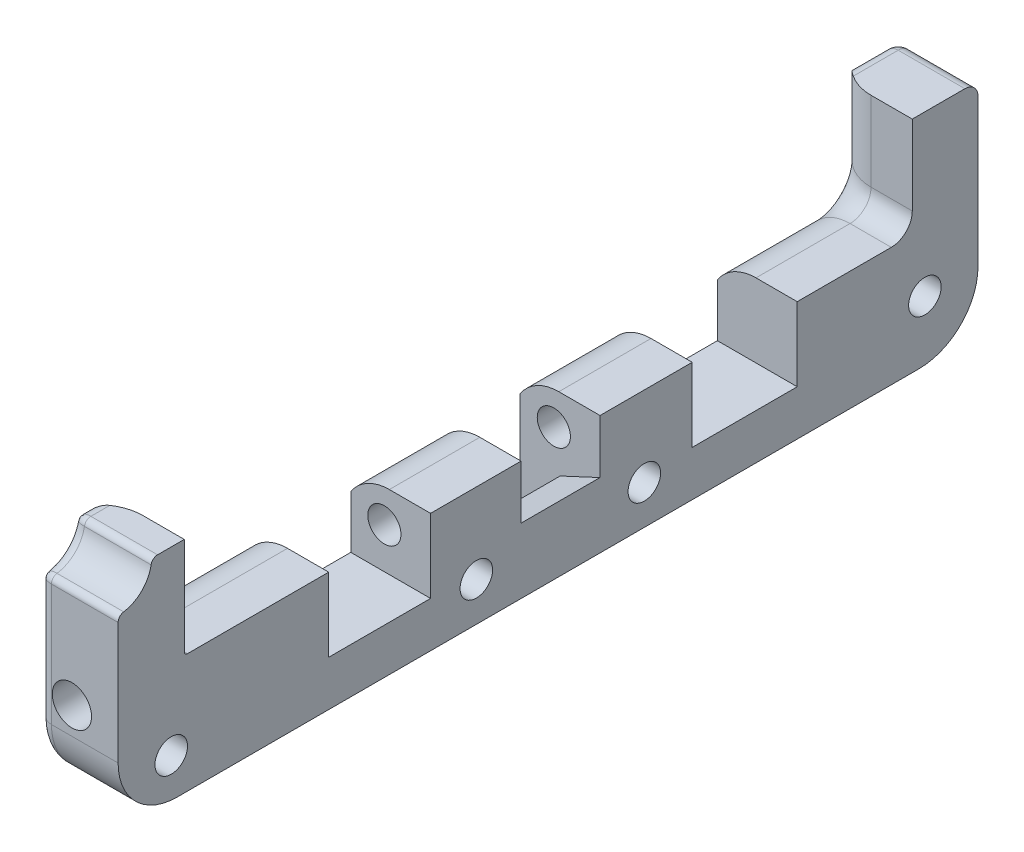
SolidWorks part; units mm, degrees
ref_plane "Спереди" through (0, 0, 0) normal (0, 0, 1) x (1, 0, 0)
ref_plane "Сверху" through (0, 0, 0) normal (0, 1, 0) x (1, 0, 0)
ref_plane "Справа" through (0, 0, 0) normal (1, 0, 0) x (0, 0, -1)
sketch "Эскиз1" plane through (0, 0, 0) normal (1, 0, 0) x (0, 0, -1)
  line L0 (-1.6541, 21.844) -> (1.5748, 21.844)
  line L1 (1.5748, 21.844) -> (1.5748, 10.0743)
  line L2 (1.9717, 9.6774) -> (19.05, 9.6774)
  line L3 (19.05, 9.6774) -> (19.05, 0.762)
  line L4 (19.05, 0.762) -> (31.369, 0.762)
  line L5 (31.369, 0.762) -> (31.369, 9.6774)
  line L6 (31.369, 9.6774) -> (42.3164, 9.6774)
  line L7 (42.3164, 9.6774) -> (42.3164, 3.175)
  line L8 (42.3164, 3.175) -> (51.8668, 3.175)
  line L9 (51.8668, 3.175) -> (51.8668, 9.6774)
  line L10 (51.8668, 9.6774) -> (63.0174, 9.6774)
  line L11 (63.0174, 9.6774) -> (63.0174, 0.762)
  line L12 (63.0174, 0.762) -> (75.7174, 0.762)
  line L13 (75.7174, 0.762) -> (75.7174, 9.6774)
  line L14 (75.7174, 9.6774) -> (87.0966, 9.6774)
  line L15 (89.6366, 12.2174) -> (89.6366, 21.844)
  line L16 (89.6366, 21.844) -> (95.9993, 21.844)
  line L17 (97.5868, 20.2565) -> (97.5868, 2.4194)
  line L18 (90.443, -4.7244) -> (0.7176, -4.7244)
  line L19 (-6.4262, 2.4194) -> (-6.4262, 17.1359)
  circle A0 centre (0, 0) radius 1.9685
  circle A1 centre (36.9062, 0) radius 1.9685
  circle A2 centre (57.2262, 0) radius 1.9685
  circle A3 centre (91.1606, 2.54) radius 1.9685
  arc A4 (-5.752, 17.9206) -> (-2.4368, 21.1825) centre (-6.35, 21.844) ccw
  arc A5 (-5.752, 17.9206) -> (-6.4262, 17.1359) centre (-5.6324, 17.1359) ccw
  arc A6 (-2.4368, 21.1825) -> (-1.6541, 21.844) centre (-1.6541, 21.0503) cw
  arc A7 (97.5868, 2.4194) -> (90.443, -4.7244) centre (90.443, 2.4194) cw
  arc A8 (0.7176, -4.7244) -> (-6.4262, 2.4194) centre (0.7175, 2.4194) cw
  arc A9 (95.9993, 21.844) -> (97.5868, 20.2565) centre (95.9993, 20.2565) cw
  arc A10 (87.0966, 9.6774) -> (89.6366, 12.2174) centre (87.0966, 12.2174) ccw
  arc A11 (1.5748, 10.0743) -> (1.9717, 9.6774) centre (1.9717, 10.0743) ccw
  point P35 (-2.3813, 21.844)
  dimension "D1" = 3.937
  dimension "D22" = 3.9688
  dimension "D23" = 0.7937
  dimension "D24" = 0.7937
  dimension "D25" = 7.1437
  dimension "D26" = 1.5875
  dimension "D27" = 2.54
  dimension "D28" = 0.3969
  dimension "D2" = 36.9062
  dimension "D3" = 57.2262
  dimension "D4" = 91.1606
  dimension "D5" = 2.54
  dimension "D6" = 9.6774
  dimension "D7" = 26.5684
  dimension "D8" = 19.05
  dimension "D9" = 5.4864
  dimension "D10" = 3.175
  dimension "D11" = 1.5748
  dimension "D12" = 104.013
  dimension "D13" = 6.4262
  dimension "D14" = 2.3813
  dimension "D15" = 9.5504
  dimension "D16" = 31.369
  dimension "D17" = 42.3164
  dimension "D18" = 63.0174
  dimension "D19" = 75.7174
  dimension "D20" = 89.6366
  dimension "D21" = 4.7244
extrude "Бобышка-Вытянуть1" add sketch "Эскиз1" along normal blind 9.652
sketch "Эскиз2" plane through (0, 0, 6.4262) normal (0, 0, 1) x (1, 0, 0)
  line L0 (9.652, 17.1359) -> (9.652, 2.4194) construction
  circle A0 centre (4.064, 5.6769) radius 2.3749
  dimension "D1" = 4.7498
  dimension "D2" = 5.6769
  dimension "D3" = 5.588
extrude "Вырез-Вытянуть1" cut sketch "Эскиз2" against normal up to surface (25.4762 mm away)
sketch "Эскиз3" plane through (0, 0, -31.369) normal (0, 0, 1) x (1, 0, 0)
  circle A0 centre (4.064, 5.6769) radius 2.0066
  circle A1 centre (4.064, 5.6769) radius 2.3749 construction
  dimension "D1" = 4.0132
extrude "Вырез-Вытянуть2" cut sketch "Эскиз3" against normal up to surface (31.6484 mm away)
sketch "Эскиз4" plane through (0, 0, -51.8668) normal (0, 0, 1) x (1, 0, 0)
  line L0 (9.652, 3.175) -> (4.826, 0.9246)
  line L1 (9.652, 9.6774) -> (9.652, 3.175) construction
  line L2 (9.652, 3.175) -> (0, 3.175) construction
  line L3 (4.826, 0.9246) -> (4.826, -4.7244)
  line L4 (4.826, -4.7244) -> (0, -4.7244)
  line L5 (0, -4.7244) -> (0, 3.175)
  line L6 (0, 3.175) -> (9.652, 3.175)
  line L7 (0, 9.6774) -> (0, 3.175) construction
  line L8 (9.652, -4.7244) -> (0, -4.7244) construction
  dimension "D1" = 25
  dimension "D2" = 4.826
extrude "Вырез-Вытянуть3" cut sketch "Эскиз4" along normal up to surface (9.5504 mm away)
chamfer "Фаска1" distance 1.5748 angle 30 4 edges at (0, 0, -1.9685) (0, 0, -38.8747) (0, 0, -59.1947) (0, 2.54, -93.1291)
fillet "Скругление1" radius 1.5875 12 edges at (0, 21.379, -97.1218) (0, 21.844, -92.8179) (0, 11.3379, -97.5868) (0, -2.632, -95.4944) (0, 21.6565, 2.1665) (0, 17.6531, 6.2345) (0, -4.7244, -21.517) (0, -2.632, 4.3338) (0, 21.844, 0.0397) (0, 19.015, 3.5665) (0, -4.7244, -71.1549) (0, 9.7776, 6.4262)
sketch "Эскиз5" plane through (0, 0, 0) normal (-1, 0, 0) x (0, 0, 1)
  line L0 (-1.5748, 21.844) -> (-1.5748, 10.0743)
  line L1 (-1.5748, 10.0743) -> (-1.5748, 20.2565) construction
  line L2 (-95.9993, 21.844) -> (-89.6366, 21.844) construction
  line L3 (-19.05, 9.6774) -> (-1.9717, 9.6774) construction
  line L4 (-1.9717, 9.6774) -> (-87.0966, 9.6774)
  line L5 (-87.0966, 9.6774) -> (-75.7174, 9.6774) construction
  line L6 (-1.5748, 21.844) -> (1.6541, 21.844) construction
  line L7 (-89.6366, 20.2565) -> (-89.6366, 12.2174) construction
  line L8 (-89.6366, 12.2174) -> (-89.6366, 21.844)
  arc A0 (-87.0966, 9.6774) -> (-89.6366, 12.2174) centre (-87.0966, 12.2174) cw
  arc A1 (-1.5748, 10.0743) -> (-1.9717, 9.6774) centre (-1.9717, 10.0743) cw
  arc A2 (-1.9717, 9.6774) -> (-1.5748, 10.0743) centre (-1.9717, 10.0743) ccw construction
  arc A3 (-89.6366, 12.2174) -> (-87.0966, 9.6774) centre (-87.0966, 12.2174) ccw construction
sketch "Эскиз6" plane through (0, 21.844, 0) normal (0, 1, 0) x (1, 0, 0)
  line L0 (4.6663, 1.5748) -> (0, 1.5748)
  line L1 (9.652, 1.5748) -> (1.5875, 1.5748) construction
  line L2 (0, 1.5748) -> (0, -0.9652)
  arc A0 (0, -0.9652) -> (4.6663, 1.5748) centre (4.6663, -3.9814) cw
  dimension "D1" = 5.5562
  dimension "D2" = 2.54
sweep "Вырез-По траектории1" cut profiles "Эскиз6" path "Эскиз5"
